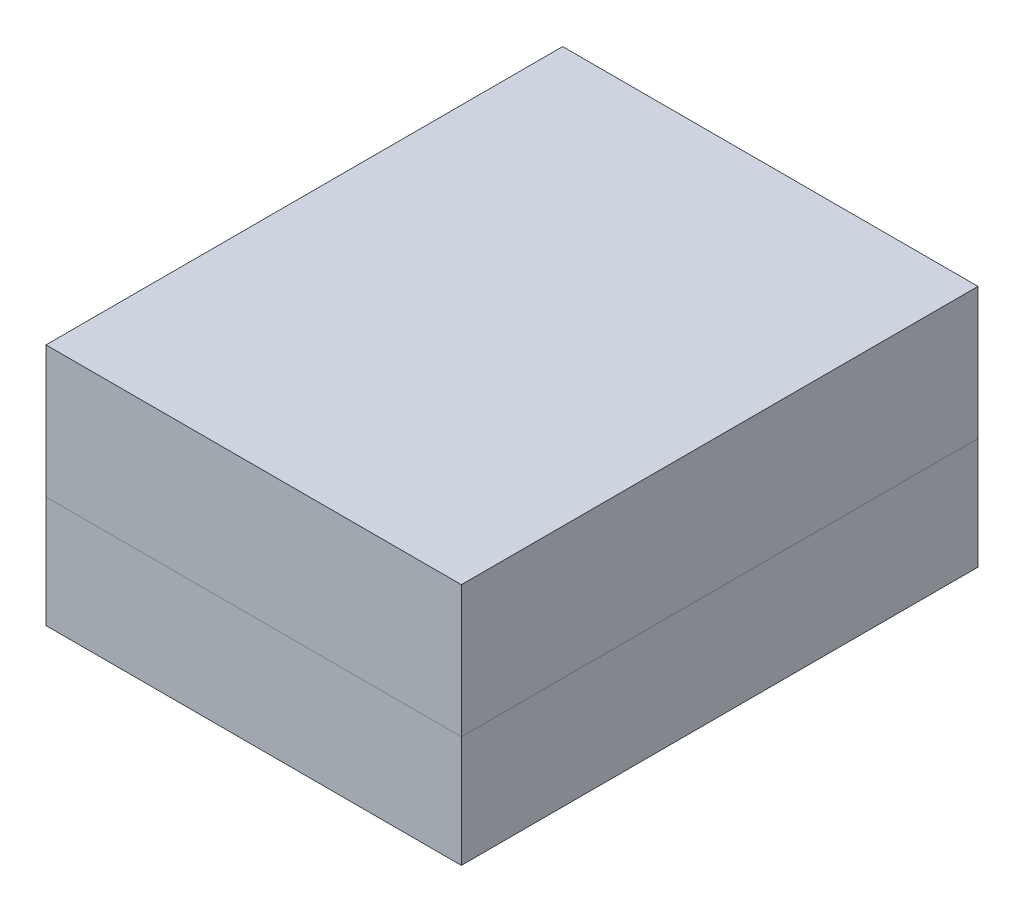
SolidWorks part; units mm, degrees
ref_plane "前视基准面" through (0, 0, 0) normal (0, 0, 1) x (1, 0, 0)
ref_plane "上视基准面" through (0, 0, 0) normal (0, 1, 0) x (1, 0, 0)
ref_plane "右视基准面" through (0, 0, 0) normal (1, 0, 0) x (0, 0, -1)
sketch "草图1" plane through (0, 0, 0) normal (0, 1, 0) x (1, 0, 0)
  line L9 (-70.7014, 13.8049) -> (-69.4514, 13.8049)
  line L10 (-70.8014, 13.7049) -> (-70.8014, 12.6549)
  line L11 (-70.7014, 12.5549) -> (-69.4514, 12.5549)
  line L12 (-69.3514, 13.7049) -> (-69.3514, 12.6549)
  line L13 (-70.7014, 12.5549) -> (-70.8014, 12.6549)
  line L14 (-70.7014, 12.3049) -> (-70.3514, 12.3049)
  line L15 (-70.8014, 12.2049) -> (-70.8014, 12.0549)
  line L16 (-70.7014, 11.9549) -> (-70.3514, 11.9549)
  line L17 (-70.2514, 12.2049) -> (-70.2514, 12.0549)
  line L18 (-69.8014, 11.9549) -> (-69.4514, 11.9549)
  line L19 (-69.3514, 12.2049) -> (-69.3514, 12.0549)
  line L20 (-69.9014, 12.2049) -> (-69.9014, 12.0549)
  line L21 (-69.8014, 12.3049) -> (-69.4514, 12.3049)
  arc A1 (-69.3514, 13.7049) -> (-69.4514, 13.8049) centre (-69.4514, 13.7049) ccw
  arc A2 (-70.7014, 13.8049) -> (-70.8014, 13.7049) centre (-70.7014, 13.7049) ccw
  arc A3 (-70.7014, 11.9549) -> (-70.8014, 12.0549) centre (-70.7014, 12.0549) cw
  arc A4 (-70.2514, 12.0549) -> (-70.3514, 11.9549) centre (-70.3514, 12.0549) cw
  arc A5 (-70.2514, 12.2049) -> (-70.3514, 12.3049) centre (-70.3514, 12.2049) ccw
  arc A6 (-70.8014, 12.2049) -> (-70.7014, 12.3049) centre (-70.7014, 12.2049) cw
  arc A7 (-69.9014, 12.2049) -> (-69.8014, 12.3049) centre (-69.8014, 12.2049) cw
  arc A8 (-69.3514, 12.0549) -> (-69.4514, 11.9549) centre (-69.4514, 12.0549) cw
  arc A9 (-69.8014, 11.9549) -> (-69.9014, 12.0549) centre (-69.8014, 12.0549) cw
  arc A10 (-69.3514, 12.2049) -> (-69.4514, 12.3049) centre (-69.4514, 12.2049) ccw
  arc A11 (-69.4514, 12.5549) -> (-69.3514, 12.6549) centre (-69.4514, 12.6549) ccw
  point P9 (-69.3514, 12.5549)
extrude "凸台-拉伸6" add sketch "草图1" against normal blind 0.06
sketch "草图3" plane through (0, 0, 0) normal (0, 1, 0) x (1, 0, 0)
  line L1 (-70.8964, 13.8999) -> (-69.2564, 13.8999)
  line L2 (-70.8964, 13.8999) -> (-70.8964, 11.8599)
  line L3 (-70.8964, 11.8599) -> (-69.2564, 11.8599)
  line L4 (-69.2564, 13.8999) -> (-69.2564, 11.8599)
extrude "凸台-拉伸8" add sketch "草图3" along normal blind 0.44 separate body
ref_plane "基准面5" through (0, 0.44, 0) normal (0, -1, 0) x (-1, 0, 0)
sketch "草图8" plane through (0, 0.44, 0) normal (0, -1, 0) x (-1, 0, 0)
  line L1 (70.8964, 13.8999) -> (69.2564, 13.8999)
  line L2 (70.8964, 13.8999) -> (70.8964, 11.8599)
  line L3 (70.8964, 11.8599) -> (69.2564, 11.8599)
  line L4 (69.2564, 13.8999) -> (69.2564, 11.8599)
extrude "凸台-拉伸9" add sketch "草图8" against normal blind 0.52 separate body
